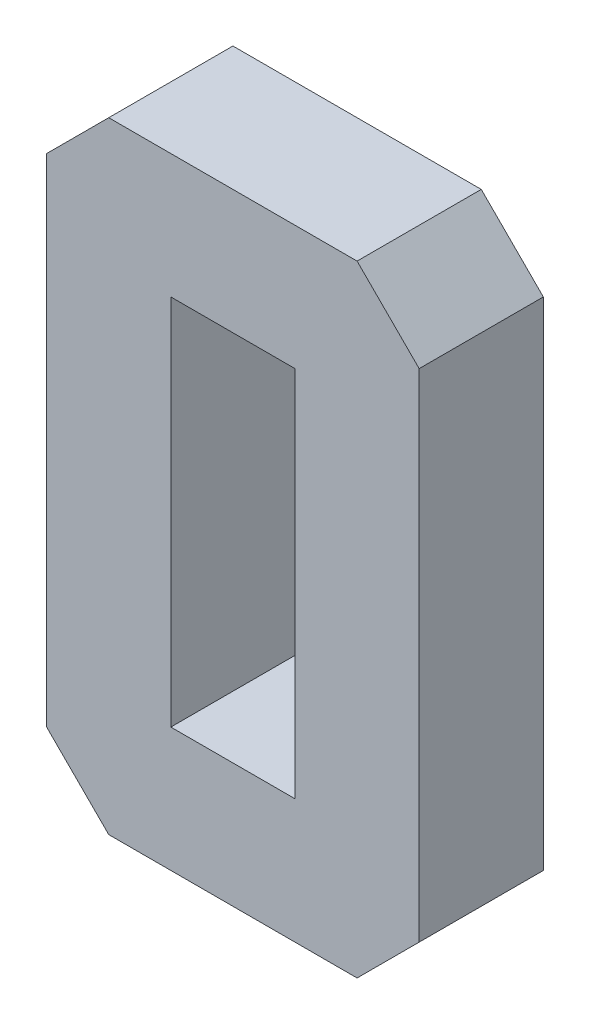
SolidWorks part; units mm, degrees
ref_plane "Plan de face" through (0, 0, 0) normal (0, 0, 1) x (1, 0, 0)
ref_plane "Plan de dessus" through (0, 0, 0) normal (0, 1, 0) x (1, 0, 0)
ref_plane "Plan de droite" through (0, 0, 0) normal (1, 0, 0) x (0, 0, -1)
sketch "Esquisse1" plane through (0, 0, 0) normal (0, 0, 1) x (1, 0, 0)
  line L1 (0, 0) -> (30, 0)
  line L2 (0, 0) -> (0, 50)
  line L3 (0, 50) -> (30, 50)
  line L4 (30, 0) -> (30, 50)
  line L5 (10, 40) -> (20, 40)
  line L6 (10, 40) -> (10, 10)
  line L7 (10, 10) -> (20, 10)
  line L8 (20, 40) -> (20, 10)
  dimension "D1" = 50
  dimension "D2" = 30
  dimension "D3" = 10
  dimension "D4" = 30
  dimension "D5" = 10
  dimension "D6" = 10
extrude "Boss.-Extru.1" add sketch "Esquisse1" along normal blind 10
chamfer "Chanfrein1" distance 5 angle 45 4 edges at (0, 0, 5) (30, 0, 5) (0, 50, 5) (30, 50, 5)
